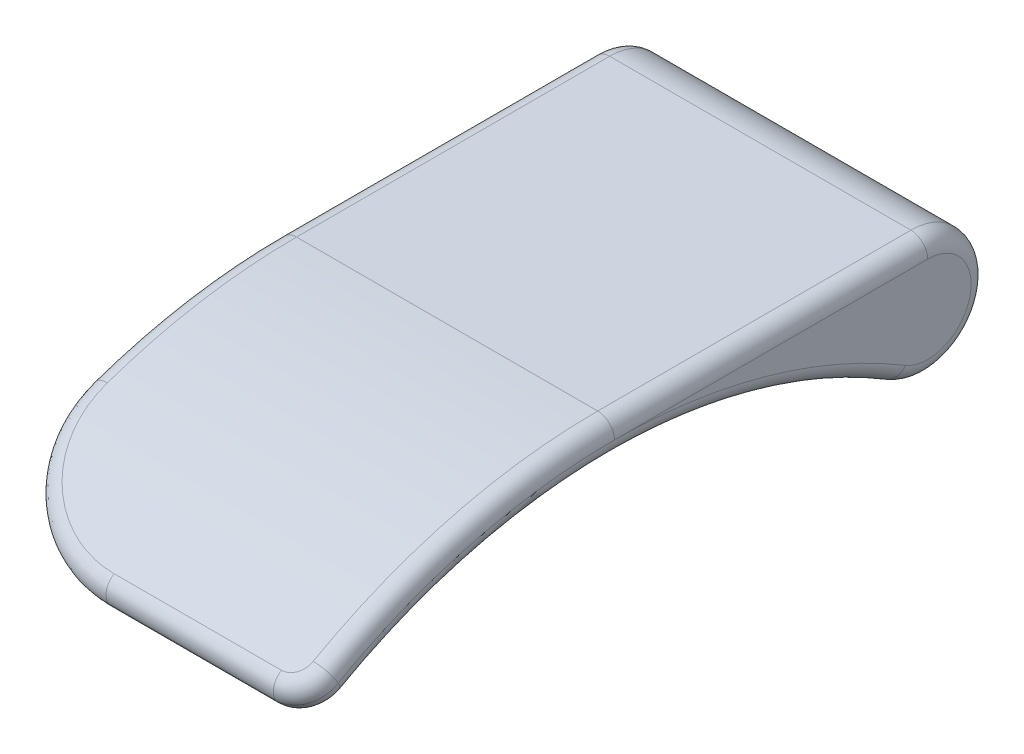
SolidWorks part; units mm, degrees
ref_plane "Plan de face" through (0, 0, 0) normal (0, 0, 1) x (1, 0, 0)
ref_plane "Plan de dessus" through (0, 0, 0) normal (0, 1, 0) x (1, 0, 0)
ref_plane "Plan de droite" through (0, 0, 0) normal (1, 0, 0) x (0, 0, -1)
sketch "Esquisse1" plane through (0, 0, 0) normal (1, 0, 0) x (0, 0, -1)
  line L0 (0, 9) -> (-46.7857, 9)
  line L1 (0, -9) -> (-91, -9) construction
  line L2 (-93.7063, -4.7957) -> (-91, -9)
  arc A0 (-4.643, -7.7099) -> (0, 9) centre (0, 0) ccw
  arc A1 (-4.643, -7.7099) -> (-91, -9) centre (-46.7857, -77.6886) ccw
  arc A2 (-46.7857, 9) -> (-93.7063, -4.7957) centre (-46.7857, -77.6886) ccw
  dimension "D1" = 18
  dimension "D2" = 100
  dimension "D3" = 5
extrude "Extrusion1" add sketch "Esquisse1" against normal blind 50
fillet "Congé2" radius 20 1 edges at (-50, -6.8979, 92.3531)
fillet "Congé3" radius 5 1 edges at (0, -6.8979, 92.3531)
fillet "Congé5" radius 2.5 14 edges at (0, 9, 23.3929) (0, -2.4095, -8.6715) (0, 3.99, 45.5045) (-1.0936, -8.0011, 89.4083) (-17.5, -9, 91) (-42.4878, -6.7292, 87.2554) (-50, 3.5176, 37.9208) (-50, -2.4095, -8.6715) (-50, 9, 23.3929) (-50, 7.7568, 61.4143) (-45.7341, -0.9379, 87.0876) (-17.5, -4.7957, 93.7063) (-1.8766, -4.2085, 92.7813) (0, 6.1505, 68.8294)
